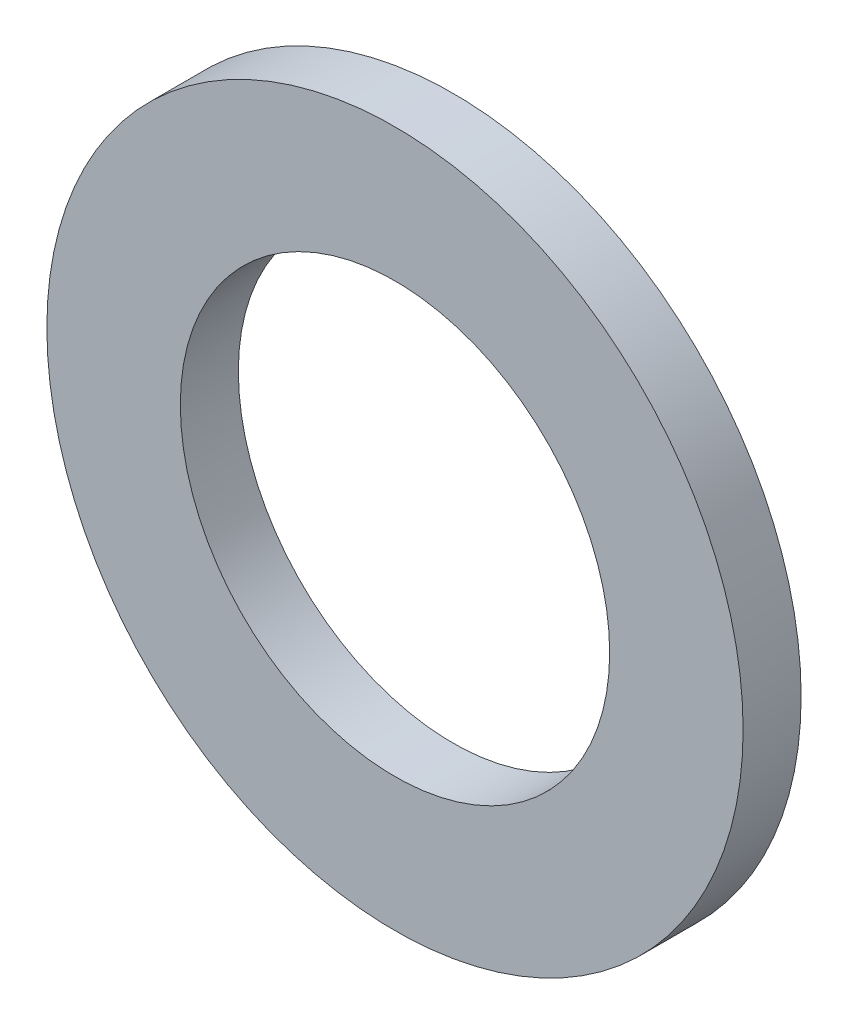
SolidWorks part; units mm, degrees
ref_plane "Front Plane" through (0, 0, 0) normal (0, 0, 1) x (1, 0, 0)
ref_plane "Top Plane" through (0, 0, 0) normal (0, 1, 0) x (1, 0, 0)
ref_plane "Right Plane" through (0, 0, 0) normal (1, 0, 0) x (0, 0, -1)
sketch "Sketch1" plane through (0, 0, 0) normal (0, 0, 1) x (1, 0, 0)
  circle A0 centre (0, 0) radius 23.495
  circle A1 centre (0, 0) radius 38.1
  dimension "D1" = 76.2
  dimension "D2" = 46.99
extrude "Boss-Extrude1" add sketch "Sketch1" along normal blind 6.35
